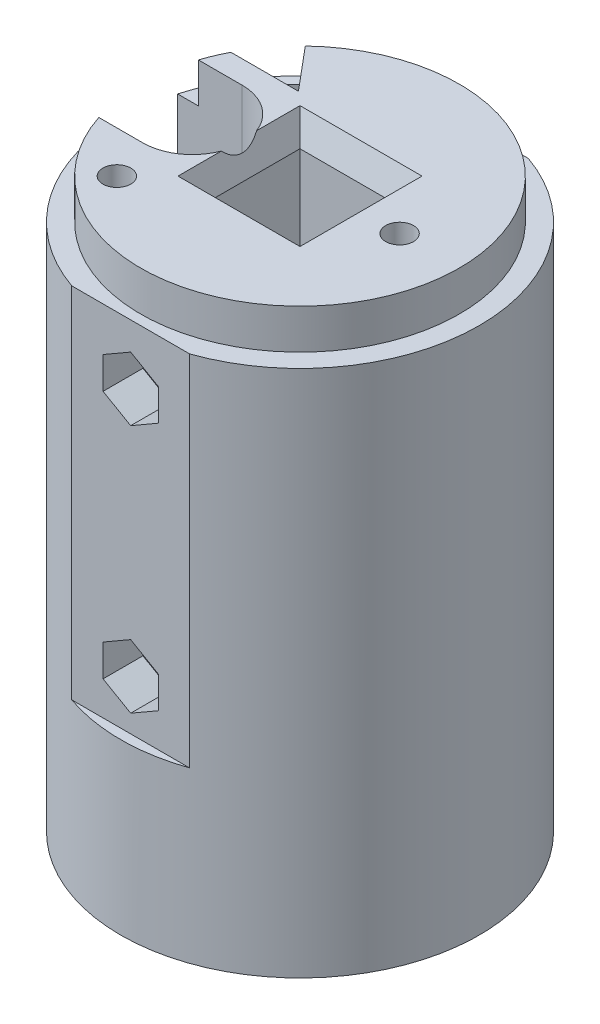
SolidWorks part; units mm, degrees
ref_plane "Спереди" through (0, 0, 0) normal (0, 0, 1) x (1, 0, 0)
ref_plane "Сверху" through (0, 0, 0) normal (0, 1, 0) x (1, 0, 0)
ref_plane "Справа" through (0, 0, 0) normal (1, 0, 0) x (0, 0, -1)
sketch "Sketch1" plane through (0, 0, 0) normal (0, 1, 0) x (1, 0, 0)
  line L0 (-5.125, 0) -> (-18, 0) construction
  line L1 (5.125, -5.125) -> (-5.125, -5.125)
  line L2 (5.125, -5.125) -> (5.125, 5.125)
  line L3 (5.125, 5.125) -> (-5.125, 5.125)
  line L4 (-5.125, -5.125) -> (-5.125, 5.125)
  line L5 (5.125, -5.125) -> (-5.125, 5.125) construction
  line L6 (5.125, 5.125) -> (-5.125, -5.125) construction
  circle A0 centre (0, 0) radius 18
  circle A1 centre (-12, 0) radius 2
  dimension "D1" = 36
  dimension "D3" = 6
  dimension "D2" = 10.25
extrude "Boss-Extrude1" add sketch "Sketch1" along normal blind 57
sketch "Sketch2" plane through (0, 57, 0) normal (0, 1, 0) x (1, 0, 0)
  line L0 (-10.8, 5) -> (-17.2916, 5)
  line L1 (-10.8, -5) -> (-17.2916, -5)
  line L2 (-5.125, 0) -> (-18, 0) construction
  line L3 (-5.125, 5.125) -> (-5.125, -5.125) construction
  circle A1 centre (0, 0) radius 18 construction
  arc A2 (-17.2916, 5) -> (-17.2916, -5) centre (0, 0) ccw
  arc A3 (-10.8, 5) -> (-10.8, -5) centre (-10.8, 0) cw
  point P12 (-5.8, 0)
  dimension "D1" = 5
extrude "Cut-Extrude1" cut sketch "Sketch2" against normal blind 27
sketch "Sketch4" plane through (0, 0, 0) normal (0, -1, 0) x (-1, 0, 0)
  line L0 (0, 0) -> (18, 21.4516) construction
  line L1 (0, 0) -> (18, -21.4516) construction
  line L2 (18, 21.4516) -> (18, -21.4516) construction
  line L3 (0, 0) -> (13.6996, 11.6756) construction
  line L4 (0, 0) -> (13.6996, -11.6756) construction
  line L5 (0, 0) -> (18, 0) construction
  line L6 (5.125, 5.125) -> (5.125, -5.125) construction
  line L7 (11.5702, 13.7888) -> (5.1423, 6.1284) construction
  line L8 (5.1423, 6.1284) -> (5.1423, -4.3826) construction
  line L9 (5.1423, -4.3826) -> (13.6996, -11.6756) construction
  line L10 (5.1423, 0.8729) -> (18.1354, 0.8729) construction
  line L12 (15.8104, 5.5479) -> (6.4604, 5.5479)
  line L13 (15.8104, 5.5479) -> (15.8104, -3.8021)
  line L14 (15.8104, -3.8021) -> (6.4604, -3.8021)
  line L15 (6.4604, 5.5479) -> (6.4604, -3.8021)
  line L16 (15.8104, 5.5479) -> (6.4604, -3.8021) construction
  line L17 (15.8104, -3.8021) -> (6.4604, 5.5479) construction
  arc A0 (13.6996, -11.6756) -> (11.5702, 13.7888) centre (0.5154, 0.0431) ccw construction
  circle A2 centre (0, 0) radius 18 construction
  point P2 (11, 0)
  point P5 (11.5702, 13.7888)
  point P7 (4.1157, 3.5076)
  point P8 (11.5702, -13.7888)
  point P11 (5.125, -6.1077)
  point P16 (11.1354, 0.8729)
  dimension "D5" = 10
  dimension "D1" = 100
  dimension "D2" = 3
  dimension "D3" = 3
  dimension "D4" = 9.35
  dimension "D6" = 7
extrude "Cut-Extrude3" cut sketch "Sketch4" against normal blind 20.4
sketch "Sketch5" plane through (0, 57, 0) normal (0, 1, 0) x (1, 0, 0)
  line L0 (0, 18) -> (0, -18) construction
  line L1 (5.9161, 17) -> (-5.9161, 17)
  line L2 (5.9161, -17) -> (-5.9161, -17)
  circle A0 centre (0, 0) radius 18 construction
  arc A1 (5.9161, 17) -> (-5.9161, 17) centre (0, 0) ccw
  arc A2 (5.9161, -17) -> (-5.9161, -17) centre (0, 0) cw
  point P11 (0, 17)
  dimension "D1" = 1
extrude "Cut-Extrude4" cut sketch "Sketch5" against normal blind 40
sketch "Sketch6" plane through (0, 0, -17) normal (0, 0, -1) x (-1, 0, 0)
  line L0 (0, 57) -> (0, 17) construction
  line L1 (5.9161, 57) -> (-5.9161, 57) construction
  line L2 (5.9161, 17) -> (-5.9161, 17) construction
  circle A0 centre (0, 47) radius 1.5
  circle A1 centre (0, 22) radius 1.5
  dimension "D1" = 3
  dimension "D2" = 10
  dimension "D3" = 5
extrude "Cut-Extrude5" cut sketch "Sketch6" against normal through all
sketch "Sketch7" plane through (0, 0, -17) normal (0, 0, -1) x (-1, 0, 0)
  circle A0 centre (0, 47) radius 3
  circle A1 centre (0, 22) radius 3
  dimension "D1" = 6
extrude "Cut-Extrude6" cut sketch "Sketch7" against normal blind 3
sketch "Sketch8" plane through (0, 0, 17) normal (0, 0, 1) x (1, 0, 0)
  line L0 (5.9161, 17) -> (5.9161, 57) construction
  line L1 (0, 43.8) -> (2.7713, 45.4)
  line L2 (2.7713, 45.4) -> (2.7713, 48.6)
  line L3 (2.7713, 48.6) -> (0, 50.2)
  line L4 (0, 50.2) -> (-2.7713, 48.6)
  line L5 (-2.7713, 48.6) -> (-2.7713, 45.4)
  line L6 (-2.7713, 45.4) -> (0, 43.8)
  line L9 (0, 18.8) -> (2.7713, 20.4)
  line L10 (2.7713, 20.4) -> (2.7713, 23.6)
  line L11 (2.7713, 23.6) -> (0, 25.2)
  line L12 (0, 25.2) -> (-2.7713, 23.6)
  line L13 (-2.7713, 23.6) -> (-2.7713, 20.4)
  line L14 (-2.7713, 20.4) -> (0, 18.8)
  circle A0 centre (0, 47) radius 3.2 construction
  circle A1 centre (0, 22) radius 3.2 construction
  dimension "D1" = 6.4
extrude "Cut-Extrude7" cut sketch "Sketch8" against normal blind 4
chamfer "Chamfer1" distance 1 angle 70 4 edges at (-5.125, 57, 0) (0, 57, -5.125) (0, 57, 5.125) (5.125, 57, 0)
sketch "Sketch9" plane through (0, 0, 0) normal (0, -1, 0) x (1, 0, 0)
  line L0 (16.4542, -7.2979) -> (-16.4542, -7.2979) construction
  line L1 (-15.8104, -5.5479) -> (-6.4604, -5.5479) construction
  line L2 (-7.4542, -7.2979) -> (-15.4542, -7.2979)
  line L3 (-7.4542, -7.2979) -> (-11.6323, -12.2772)
  line L4 (5.125, -5.125) -> (-5.125, -5.125) construction
  circle A0 centre (0, 0) radius 18 construction
  arc A1 (-15.4542, -7.2979) -> (-11.6323, -12.2772) centre (0.5168, 1.0043) ccw
  point P10 (-11.4542, -7.2979)
  dimension "D8" = 18
  dimension "D1" = 1.75
  dimension "D2" = 5
  dimension "D3" = 6.5
  dimension "D4" = 50
  dimension "D5" = 8
  dimension "D6" = 2.1729
  dimension "D7" = 23.9084
extrude "Cut-Extrude8" cut sketch "Sketch9" against normal through all
sketch "Sketch12" plane through (0, 57, 0) normal (0, 1, 0) x (1, 0, 0)
  line L0 (18, 0) -> (-10.8, 0) construction
  line L1 (0, 0) -> (-12.7279, -12.7279) construction
  arc A0 (5.9161, -17) -> (5.9161, 17) centre (0, 0) ccw construction
  arc A1 (-17.2916, -5) -> (-5.9161, -17) centre (0, 0) ccw construction
  circle A2 centre (10, 0) radius 1.4
  circle A3 centre (-9.1924, -9.1924) radius 1.4
  dimension "D1" = 2.8
  dimension "D2" = 10
  dimension "D3" = 13
extrude "Cut-Extrude10" cut sketch "Sketch12" against normal blind 20
sketch "Sketch10" plane through (0, 57, 0) normal (0, 1, 0) x (1, 0, 0)
  circle A1 centre (0, 0) radius 18
  circle A2 centre (0, 0) radius 16
  arc A3 (-17.2916, -5) -> (-5.9161, -17) centre (0, 0) ccw construction
  dimension "D1" = 2
extrude "Cut-Extrude9" cut sketch "Sketch10" against normal blind 4
